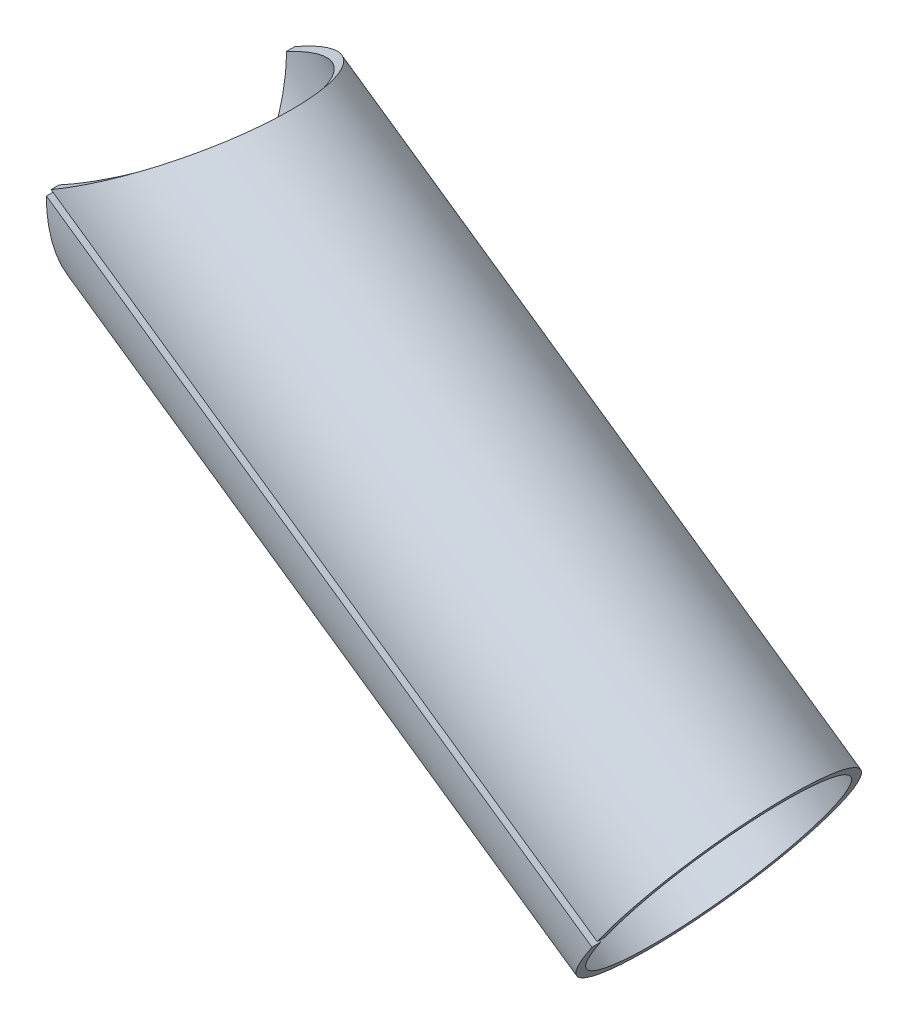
SolidWorks part; units mm, degrees
ref_plane "前视基准面" through (0, 0, 0) normal (0, 0, 1) x (1, 0, 0)
ref_plane "上视基准面" through (0, 0, 0) normal (0, 1, 0) x (1, 0, 0)
ref_plane "右视基准面" through (0, 0, 0) normal (1, 0, 0) x (0, 0, -1)
imported_body "基体零件-任意角度Y形三通管-1"
sheet metal parameters "钣金1" parameters "D1"=0.7366, "厚度"=1
bend "圆角折弯1" bend radius 13.6769 bend angle 355.81 parameters "D5"=1
flatten bends "展开-折弯1"
sketch "尖角-草图1" plane through (32.767, -22.0807, 13.6677) normal (-0.0208, -0.0301, -0.9993) x (-0.9998, 0.0006, 0.0208)
  line L0 (8.0747, 57.2303) -> (-56.4387, 12.589) construction
  dimension "D1" = 0
process bends "加工-折弯1" parameters "D1"=0
sketch "平面-草图1" plane through (0.2846, 0.4111, 13.6677) normal (-0.0208, -0.0301, -0.9993) x (-0.9998, 0.0006, 0.0208)
